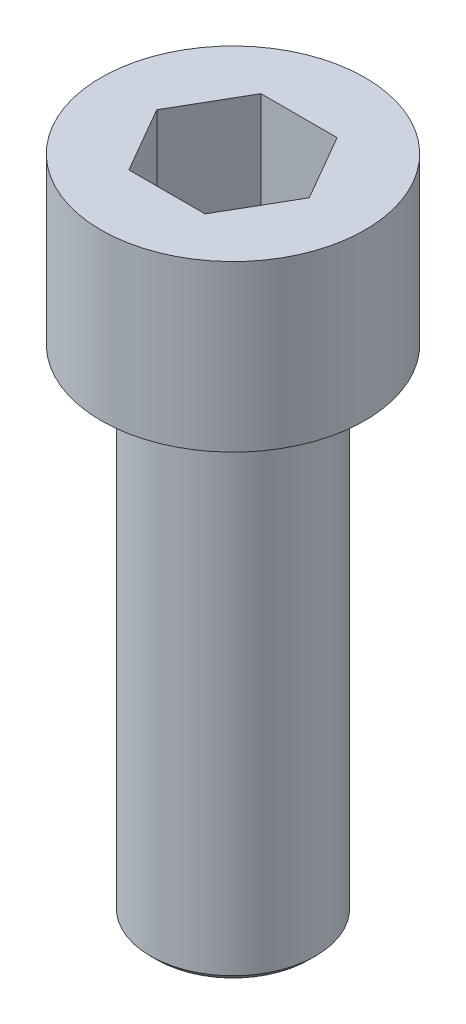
SolidWorks part; units mm, degrees
ref_plane "Front Plane" through (0, 0, 0) normal (0, 0, 1) x (1, 0, 0)
ref_plane "Top Plane" through (0, 0, 0) normal (0, 1, 0) x (1, 0, 0)
ref_plane "Right Plane" through (0, 0, 0) normal (1, 0, 0) x (0, 0, -1)
sketch "Sketch1" plane through (0, 0, 0) normal (0, 0, 1) x (1, 0, 0)
  line L0 (0, 0) -> (24, 0)
  line L1 (24, 0) -> (24, -30)
  line L2 (24, -30) -> (15, -30)
  line L3 (15, -30) -> (15, -120)
  line L4 (15, -120) -> (0, -120)
  line L5 (0, -120) -> (0, 0)
  line L6 (0, 39.1612) -> (0, -161.5454) construction
  dimension "Base Diameter" = 30
  dimension "Height" = 90
  dimension "Head Thickness" = 30
  dimension "Head Dia" = 48
revolve "Revolve1" add sketch "Sketch1" angle 360 about L6
sketch "Sketch2" plane through (0, 0, 0) normal (0, 1, 0) x (1, 0, 0)
  line L0 (0, 0) -> (36.3315, 0) construction
  line L1 (13.8564, 0) -> (6.9282, 12)
  line L2 (6.9282, 12) -> (-6.9282, 12)
  line L3 (-6.9282, 12) -> (-13.8564, 0)
  line L4 (-13.8564, 0) -> (-6.9282, -12)
  line L5 (-6.9282, -12) -> (6.9282, -12)
  line L6 (6.9282, -12) -> (13.8564, 0)
  circle A0 centre (0, 0) radius 12 construction
  dimension "Hexagon" = 24
extrude "Cut-Extrude1" cut sketch "Sketch2" against normal blind 18
fillet "Fillet1" radius 1.2 1 edges at (0, -30, 15)
chamfer "Chamfer1" distance 1.2 angle 45 1 edges at (0, -120, 15)
equation "\"Height@Sketch1\" = \"Base Diameter@Sketch1\" * 3'Height"
equation "\"Head Thickness@Sketch1\" = \"Base Diameter@Sketch1\" * 1'Base Diameter"
equation "\"Head Dia@Sketch1\" = 1.6 * 30'Head Diameter"
equation "\"Hexagon@Sketch2\" = 0.8 * 30'Hexagon"
equation "\"D1@Cut-Extrude1\" = .6 * 30'Height of Hexagon"
equation "\"D1@Fillet1\" = 0.04 * 30 'Fillet"
equation "\"D1@Chamfer1\"= 0.04 * 30 'Chamfer"
